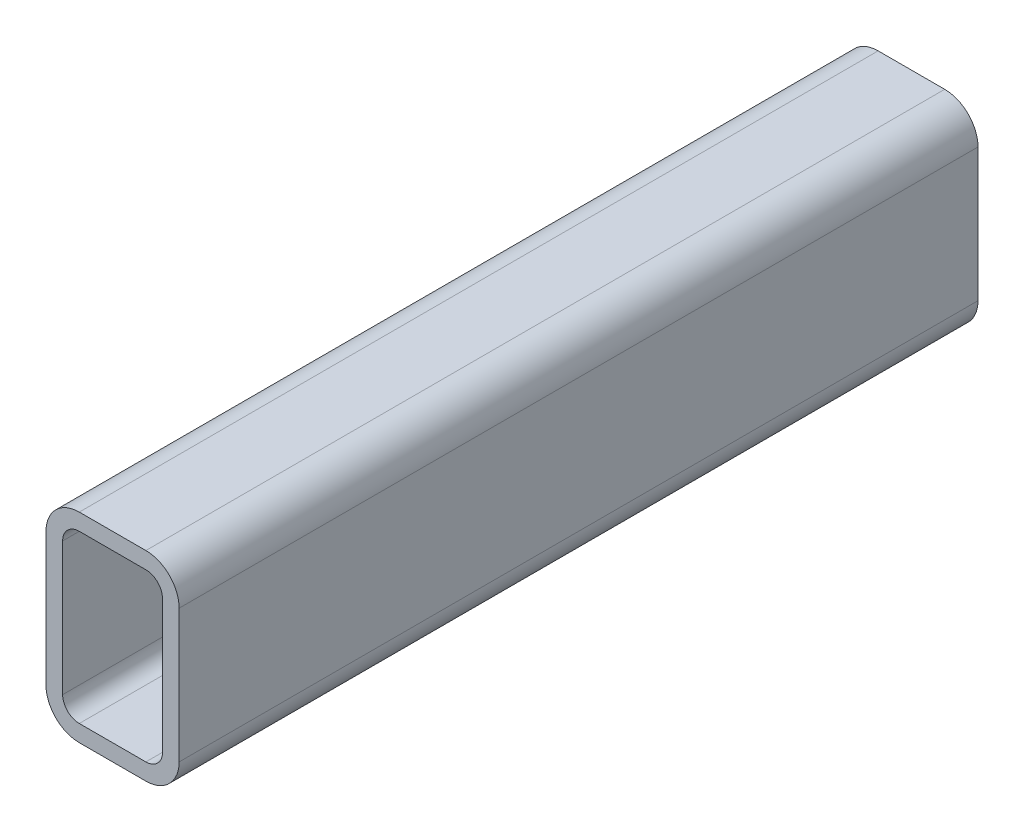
SolidWorks part; units mm, degrees
ref_plane "Front Plane" through (0, 0, 0) normal (0, 0, 1) x (1, 0, 0)
ref_plane "Top Plane" through (0, 0, 0) normal (0, 1, 0) x (1, 0, 0)
ref_plane "Right Plane" through (0, 0, 0) normal (1, 0, 0) x (0, 0, -1)
sketch "Sketch1" plane through (0, 0, 0) normal (0, 0, 1) x (1, 0, 0)
  line B0 (12.7, 76.2) -> (38.1, 76.2)
  arc B1 (50.8, 63.5) -> (38.1, 76.2) centre (38.1, 63.5) ccw
  line B2 (50.8, 63.5) -> (50.8, 12.7)
  arc B3 (38.1, 0) -> (50.8, 12.7) centre (38.1, 12.7) ccw
  line B4 (38.1, 0) -> (12.7, 0)
  arc B5 (0, 12.7) -> (12.7, 0) centre (12.7, 12.7) ccw
  line B6 (0, 12.7) -> (0, 63.5)
  arc B7 (12.7, 76.2) -> (0, 63.5) centre (12.7, 63.5) ccw
  line B8 (12.7, 69.85) -> (38.1, 69.85)
  arc B9 (44.45, 63.5) -> (38.1, 69.85) centre (38.1, 63.5) ccw
  line B10 (44.45, 63.5) -> (44.45, 12.7)
  arc B11 (38.1, 6.35) -> (44.45, 12.7) centre (38.1, 12.7) ccw
  line B12 (38.1, 6.35) -> (12.7, 6.35)
  arc B13 (6.35, 12.7) -> (12.7, 6.35) centre (12.7, 12.7) ccw
  line B14 (6.35, 12.7) -> (6.35, 63.5)
  arc B15 (12.7, 69.85) -> (6.35, 63.5) centre (12.7, 63.5) ccw
sketch_block_instance "HSS3x2x0.250-1"
sketch_block "HSS3x2x0.250"
extrude "Boss-Extrude1" add sketch "Sketch1" along normal blind 304.8
